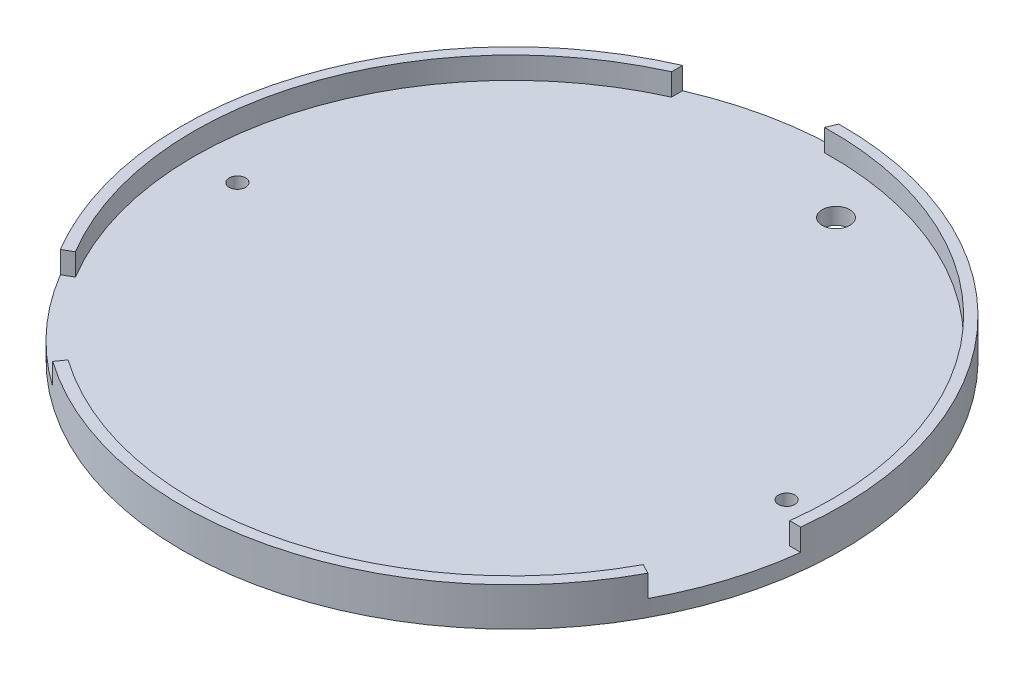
SolidWorks part; units mm, degrees
ref_plane "Front Plane" through (0, 0, 0) normal (0, 0, 1) x (1, 0, 0)
ref_plane "Top Plane" through (0, 0, 0) normal (0, 1, 0) x (1, 0, 0)
ref_plane "Right Plane" through (0, 0, 0) normal (1, 0, 0) x (0, 0, -1)
sketch "Sketch1" plane through (0, 0, 0) normal (0, 1, 0) x (1, 0, 0)
  circle A0 centre (0, 0) radius 60
  dimension "D1" = 120
extrude "Boss-Extrude1" add sketch "Sketch1" along normal blind 3
sketch "Sketch2" plane through (0, 3, 0) normal (0, 1, 0) x (1, 0, 0)
  circle A2 centre (50, 0) radius 1.5
  circle A3 centre (-50, 0) radius 1.5
  circle A4 centre (10, 48.9898) radius 2.5
  dimension "D1" = 3
  dimension "3" = 3
  dimension "D4" = 5
  dimension "D5" = 10
  dimension "D2" = 100
  dimension "D3" = 50
  dimension "50" = 50
extrude "Cut-Extrude1" cut sketch "Sketch2" against normal up to next
sketch "Sketch3" plane through (0, 0, 0) normal (0, -1, 0) x (-1, 0, 0)
  line L0 (34.6179, -49.0062) -> (33.4639, -47.3726)
  line L1 (-52.949, -28.2206) -> (-51.1841, -27.2799)
  line L2 (51.584, -30.6445) -> (49.8482, -29.6511)
  line L3 (23.9562, 55.01) -> (23.9562, 53.01)
  line L4 (0.4802, 59.9981) -> (1.2616, 58.157)
  line L5 (-59.5875, -7.0233) -> (-57.5875, -7.0233)
  arc A0 (-52.949, -28.2206) -> (34.6179, -49.0062) centre (0, 0) ccw
  circle A1 centre (0, 0) radius 60 construction
  arc A2 (33.4639, -47.3726) -> (-51.1841, -27.2799) centre (0, 0) cw
  arc A3 (23.9562, 55.01) -> (51.584, -30.6445) centre (0, 0) cw
  arc A4 (49.8482, -29.6511) -> (23.9562, 53.01) centre (0.0889, 0.1484) ccw
  arc A5 (0.4802, 59.9981) -> (-59.5875, -7.0233) centre (0, 0) ccw
  arc A6 (1.2616, 58.157) -> (-57.5875, -7.0233) centre (-0.0355, 0.1715) ccw
  dimension "D1" = 60
  dimension "D2" = 2
  dimension "D3" = 60
  dimension "D4" = 58
  dimension "D5" = 90
  dimension "D8" = 2
  dimension "D7" = 2
  dimension "D9" = 58
  dimension "D10" = 60
  dimension "D11" = 58
  dimension "D6" = 2
  dimension "2" = 2
  dimension "D12" = 90
  dimension "D13" = 2
  dimension "D14" = 90
  dimension "D15" = 22.2125
  dimension "24" = 25
  dimension "D16" = 24
extrude "Boss-Extrude2" add sketch "Sketch3" against normal blind 7
